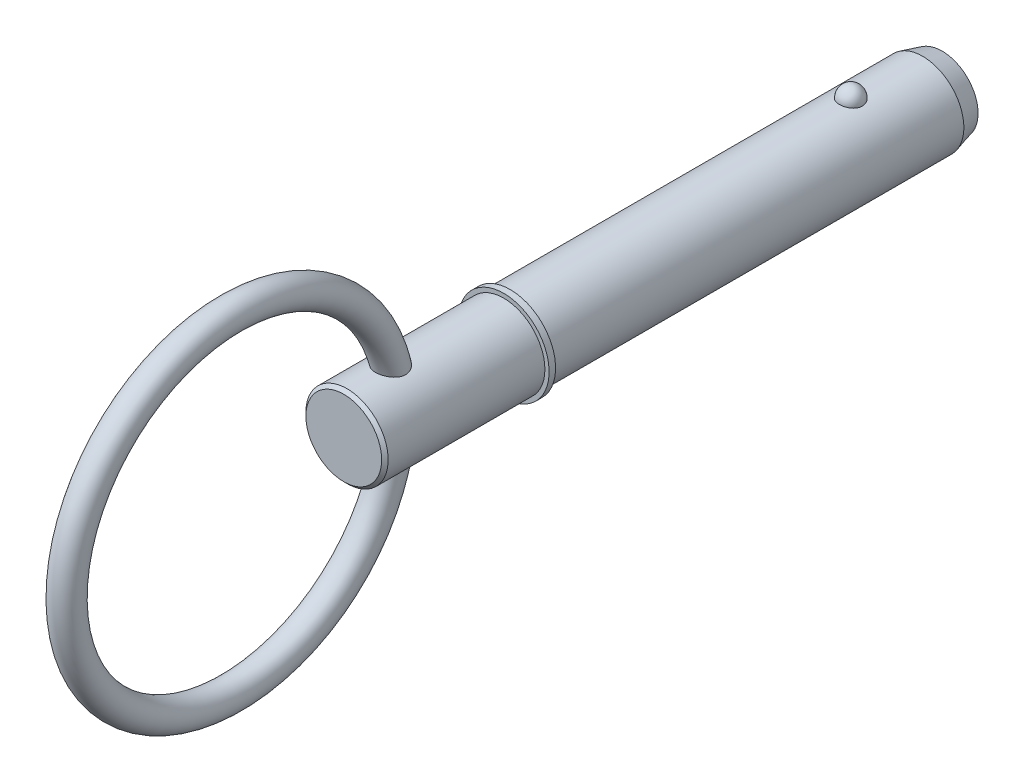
SolidWorks part; units mm, degrees
ref_plane "Front Plane" through (0, 0, 0) normal (0, 0, 1) x (1, 0, 0)
ref_plane "Top Plane" through (0, 0, 0) normal (0, 1, 0) x (1, 0, 0)
ref_plane "Right Plane" through (0, 0, 0) normal (1, 0, 0) x (0, 0, -1)
sketch "Sketch2" plane through (0, 0, 0) normal (0, 0, 1) x (1, 0, 0)
  circle A0 centre (0, 0) radius 6.35
  point P3 (0, 6.35)
  dimension "D1" = 12.7
extrude "Boss-Extrude1" add sketch "Sketch2" along normal blind 50.8
sketch "Sketch3" plane through (0, 0, 0) normal (0, 0, -1) x (-1, 0, 0)
  circle A0 centre (0, 0) radius 6.35
  dimension "D1" = 12.7
extrude "Boss-Extrude2" add sketch "Sketch3" along normal blind 15.88
chamfer "Chamfer1" distance 3 angle 15 1 edges at (-6.35, 0, -15.88)
sketch "Sketch18" plane through (0, 0, 0) normal (1, 0, 0) x (0, 0, -1)
  line L0 (12.88, 6.35) -> (-50.8, 6.35) construction
  line L1 (1.78, 8.13) -> (1.78, 4.57)
  line L2 (-50.8, -6.35) -> (12.88, -6.35) construction
  arc A0 (1.78, 8.13) -> (1.78, 4.57) centre (1.78, 6.35) ccw
  point P4 (0, 6.35)
  dimension "D1" = 14.48
revolve "Revolve1" add sketch "Sketch18" angle 360 about L1
sketch "Sketch19" plane through (0, 0, 0) normal (1, 0, 0) x (0, 0, -1)
  line L0 (-33.7288, 0) -> (-46.4542, 0) construction
sketch "Sketch20" plane through (0, 0, 0) normal (1, 0, 0) x (0, 0, -1)
  line L0 (-50.8, 0) -> (-50.8, 7)
  line L1 (-50.8, 6.35) -> (-50.8, -6.35) construction
  line L2 (-50.8, 7) -> (-51.8, 7)
  line L3 (-51.8, 7) -> (-51.8, 0)
  line L4 (-33.7288, 0) -> (-46.4542, 0) construction
  line L5 (-51.8, 0) -> (-50.8, 0)
  dimension "D1" = 7
  dimension "D2" = 1
revolve "Revolve2" add sketch "Sketch20" angle 360 about L0
sketch "Sketch21" plane through (0, 0, 50.8) normal (0, 0, -1) x (-1, 0, 0)
  circle A0 centre (0, 0) radius 6.35
  dimension "D1" = 12.7
extrude "Boss-Extrude3" add sketch "Sketch21" against normal blind 25.7
chamfer "Chamfer2" distance 0.5 angle 45 1 edges at (-6.35, 0, 76.5)
sketch "Sketch23" plane through (0, 0, 0) normal (1, 0, 0) x (0, 0, -1)
  line L0 (-76.5, 5.85) -> (-76.5, -5.85) construction
  circle A0 centre (-93.9, 0) radius 25.4
  point P2 (-68.5, 0)
  dimension "D1" = 50.8
  dimension "D2" = 8
sketch "Sketch24" plane through (0, 0, 0) normal (0, 1, 0) x (1, 0, 0)
  circle A0 centre (0, -68.5) radius 2.25
  dimension "D1" = 4.5
sweep "Sweep1" add profiles "Sketch24" path "Sketch23"
